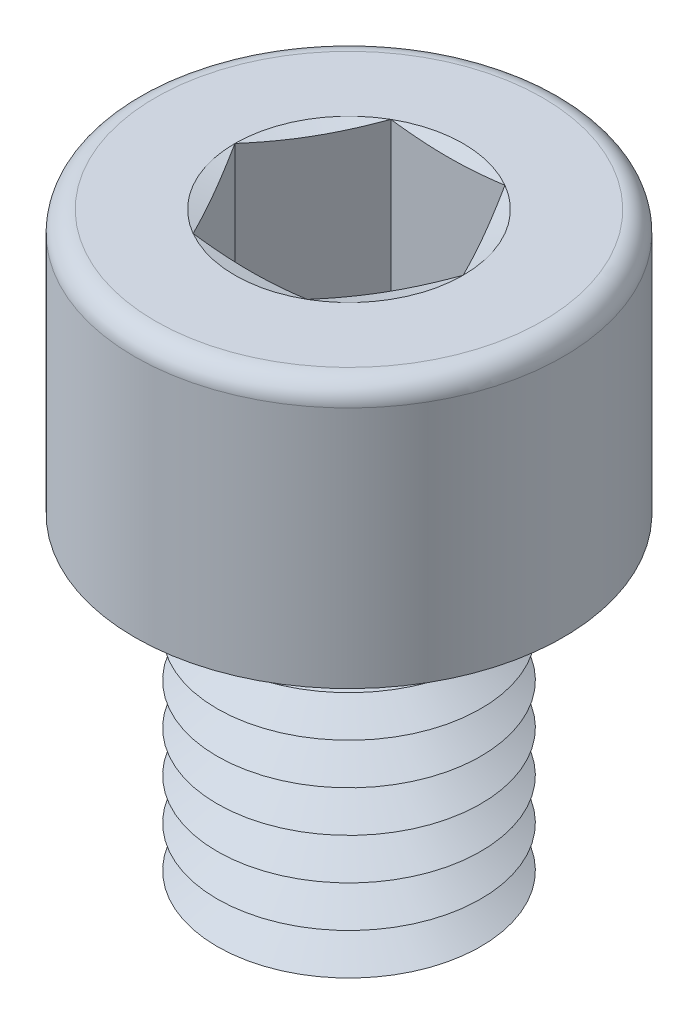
SolidWorks part; units mm, degrees
ref_plane "Front Plane" through (0, 0, 0) normal (0, 0, 1) x (1, 0, 0)
ref_plane "Top Plane" through (0, 0, 0) normal (0, 1, 0) x (1, 0, 0)
ref_plane "Right Plane" through (0, 0, 0) normal (1, 0, 0) x (0, 0, -1)
sketch "Sketch1" plane through (0, 0, 0) normal (0, 1, 0) x (1, 0, 0)
  circle A0 centre (0, 0) radius 4
  dimension "D1" = 8
extrude "Extrude1" add sketch "Sketch1" along normal blind 10
sketch "Sketch2" plane through (0, 10, 0) normal (0, 1, 0) x (1, 0, 0)
  circle A0 centre (0, 0) radius 6.5
  dimension "D1" = 13
extrude "Extrude2" add sketch "Sketch2" along normal blind 8
sketch "Sketch3" plane through (0, 18, 0) normal (0, 1, 0) x (1, 0, 0)
  line L1 (1.7321, 3) -> (-1.7321, 3)
  line L2 (-1.7321, 3) -> (-3.4641, 0)
  line L3 (-3.4641, 0) -> (-1.7321, -3)
  line L4 (-1.7321, -3) -> (1.7321, -3)
  line L5 (1.7321, -3) -> (3.4641, 0)
  line L6 (3.4641, 0) -> (1.7321, 3)
  circle A0 centre (0, 0) radius 3 construction
  dimension "D1" = 6
extrude "Extrude3" cut sketch "Sketch3" against normal blind 6
fillet "Fillet1" radius 0.625 1 edges at (0, 18, 6.5)
sketch "Sketch4" plane through (0, 0, 0) normal (1, 0, 0) x (0, 0, -1)
  line L0 (-3, 12) -> (0, 12)
  line L1 (0, 12) -> (0, 10.2679)
  line L2 (0, 10.2679) -> (-3, 12)
  dimension "D1" = 30
revolve "Cut-Revolve1" cut sketch "Sketch4" angle 360 about L1
sketch "Sketch5" plane through (0, 0, 0) normal (0, 0, 1) x (1, 0, 0)
  line L0 (-4, 0.625) -> (-4, -0.625)
  line L1 (-4, 10) -> (-4, 0) construction
  line L2 (-4, -0.625) -> (-2.9175, 0)
  line L3 (-4, 0) -> (4, 0) construction
  line L4 (-2.9175, 0) -> (-4, 0.625)
  dimension "D1" = 1.25
revolve "Cut-Revolve2" cut sketch "Sketch5" angle 360 about axis through (0, 10, 0) along (0, -1, 0)
pattern_linear "LPattern1" count 8 spacing 1.25 along (0, 1, 0) of "Cut-Revolve2"
sketch "Sketch6" plane through (0, 18, 0) normal (0, 1, 0) x (1, 0, 0)
  circle A0 centre (0, 0) radius 3.4641
extrude "Extrude4" cut sketch "Sketch6" against normal through all draft 75
